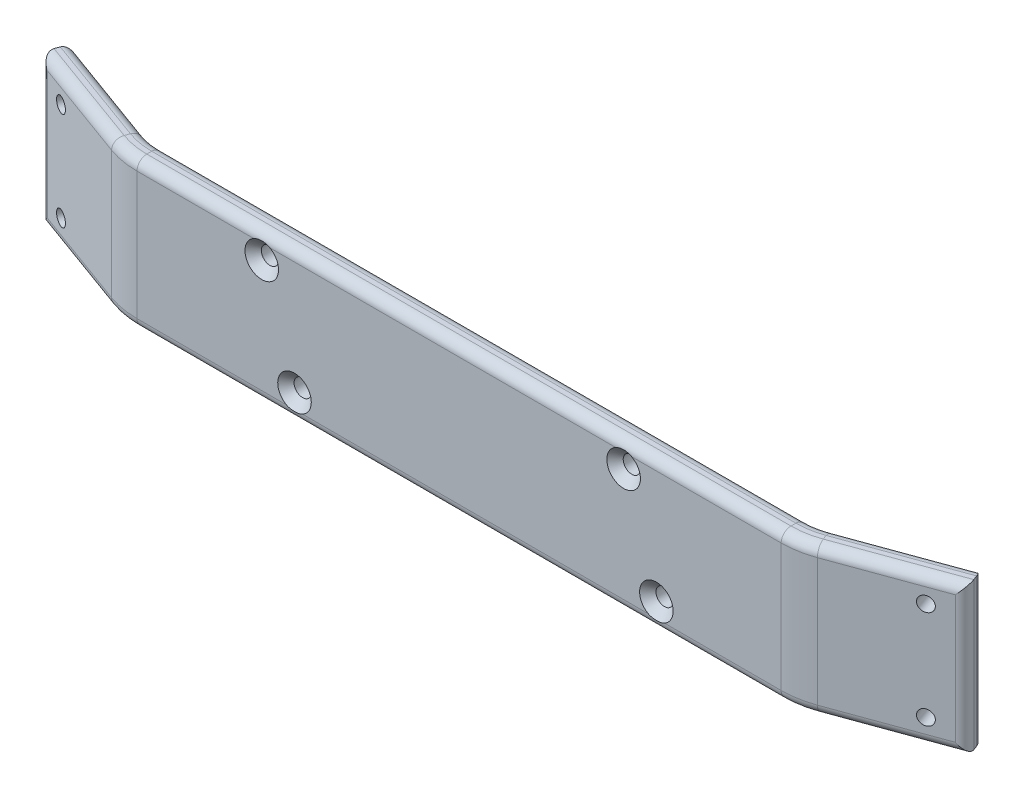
SolidWorks part; units mm, degrees
ref_plane "Plan1" through (0, 0, 0) normal (0, 0, 1) x (1, 0, 0)
ref_plane "Plan2" through (0, 0, 0) normal (0, 1, 0) x (1, 0, 0)
ref_plane "Plan3" through (0, 0, 0) normal (1, 0, 0) x (0, 0, -1)
sketch "Esquisse1" plane through (0, 0, 0) normal (0, 0, 1) x (1, 0, 0)
  line L0 (-285, 45) -> (285, 45)
  line L1 (-285, 45) -> (-285, -45)
  line L2 (285, -45) -> (-285, -45)
  line L3 (285, -45) -> (285, 45)
  circle A0 centre (-100.5, -30) radius 5.25
  circle A1 centre (120.5, -30) radius 5.25
  circle A4 centre (-265, 30) radius 4.5
  circle A5 centre (-265, -30) radius 4.5
  circle A6 centre (265, 30) radius 4.5
  circle A7 centre (265, -30) radius 4.5
  circle A10 centre (100.5, 30) radius 5.25
  circle A16 centre (-120.5, 30) radius 5.25
  point P10 (-285, -45)
  point P13 (285, 45)
  point P16 (285, -45)
  dimension "D3" = 221
  dimension "D4" = 60
  dimension "D7" = 9
  dimension "D15" = 10.5
  dimension "D1" = 90
  dimension "D2" = 570
  dimension "D5" = 15
  dimension "D6" = 20
  dimension "D8" = 60
  dimension "D9" = 15
  dimension "D10" = 20
  dimension "D11" = 184.5
  dimension "D12" = 20
  dimension "D13" = 20
  dimension "D14" = 164.5
  dimension "D16" = 120.5
  dimension "D17" = 45
extrude "Base-Extrusion" add sketch "Esquisse1" along normal blind 15
sheet metal parameters "Tôlerie 2" parameters "D1"=40
flatten bends "Dépliage 2" parameters "D1"=0
sketch "Esquisse-Angle2" plane through (0, 0, 0) normal (0, 0, -1) x (-1, 0, 0)
process bends "Pliage 2" parameters "D1"=0
sketch "Esquisse-Plate2" plane through (0, 0, 0) normal (0, 0, -1) x (-1, 0, 0)
  line L0 (-205, 45) -> (-205, -45)
  line L2 (205, 90) -> (205, -45)
  line L3 (-285, -45) -> (285, -45) construction
  line L4 (285, 45) -> (-285, 45) construction
  line L5 (-285, -45) -> (-285, 45) construction
  line L6 (285, 45) -> (285, -45) construction
  point P13 (187, 0)
  dimension "D1" = 80
  dimension "D2" = 80
bend "Pli défini à plat1" bend radius 40 bend angle 20 parameters "D5"=1
bend "Pli défini à plat2" bend radius 40 bend angle 20 parameters "D5"=2
fillet "Congé1" radius 6
chamfer "Chanfrein1" distance 5 angle 45
